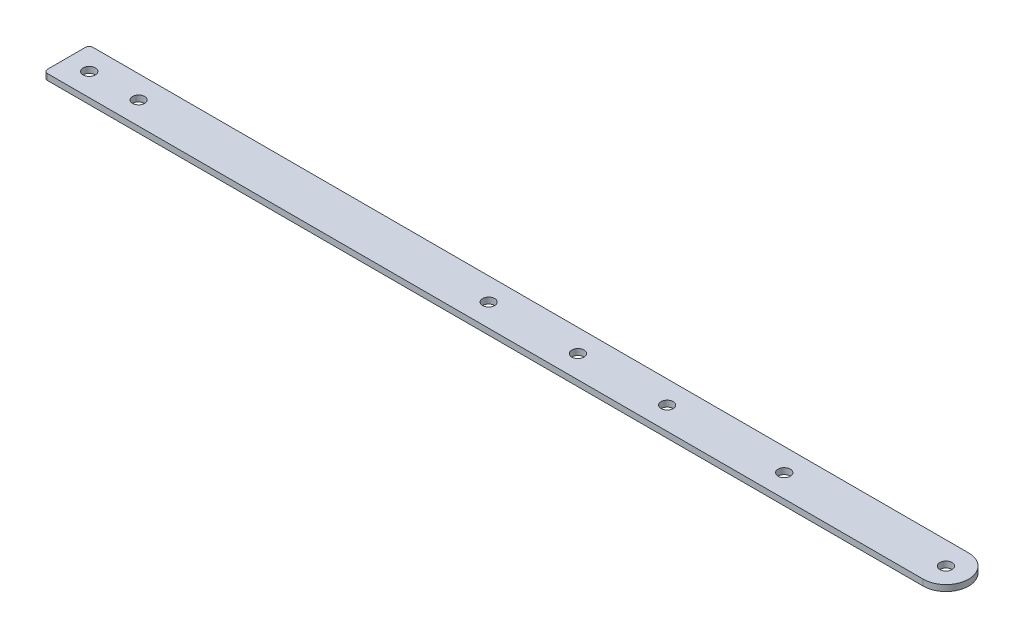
SolidWorks part; units mm, degrees
ref_plane "Piano frontale" through (0, 0, 0) normal (0, 0, 1) x (1, 0, 0)
ref_plane "Piano superiore" through (0, 0, 0) normal (0, 1, 0) x (1, 0, 0)
ref_plane "Piano destro" through (0, 0, 0) normal (1, 0, 0) x (0, 0, -1)
sketch "Schizzo1" plane through (0, 0, 0) normal (0, 1, 0) x (1, 0, 0)
  line L0 (1483.5617, 2001.5533) -> (2061.7471, 2001.5533)
  line L1 (1483.5617, 2031.5533) -> (2061.7471, 2031.5533)
  line L2 (1481.0617, 2004.0533) -> (1481.0617, 2029.0533)
  arc A0 (1483.5617, 2031.5533) -> (1481.0617, 2029.0533) centre (1483.5617, 2029.0533) ccw
  circle A1 centre (1496.0617, 2016.5533) radius 4.05
  circle A2 centre (2061.7471, 2016.5533) radius 4.05
  circle A3 centre (1954.9792, 2016.5533) radius 4.05
  arc A4 (2061.7471, 2001.5533) -> (2061.7471, 2031.5533) centre (2061.7471, 2016.5533) ccw
  circle A5 centre (1818.7525, 2016.5533) radius 4.05
  circle A6 centre (1877.67, 2016.5533) radius 4
  circle A7 centre (1759.835, 2016.5533) radius 4
  arc A8 (1481.0617, 2004.0533) -> (1483.5617, 2001.5533) centre (1483.5617, 2004.0533) ccw
  circle A9 centre (1528.667, 2016.5533) radius 4
extrude "Estrusione-Estrusione1" add sketch "Schizzo1" along normal blind 4
move or copy body "Corpo-Sposta/copia1" [suppressed] bodies to move or copy 101
